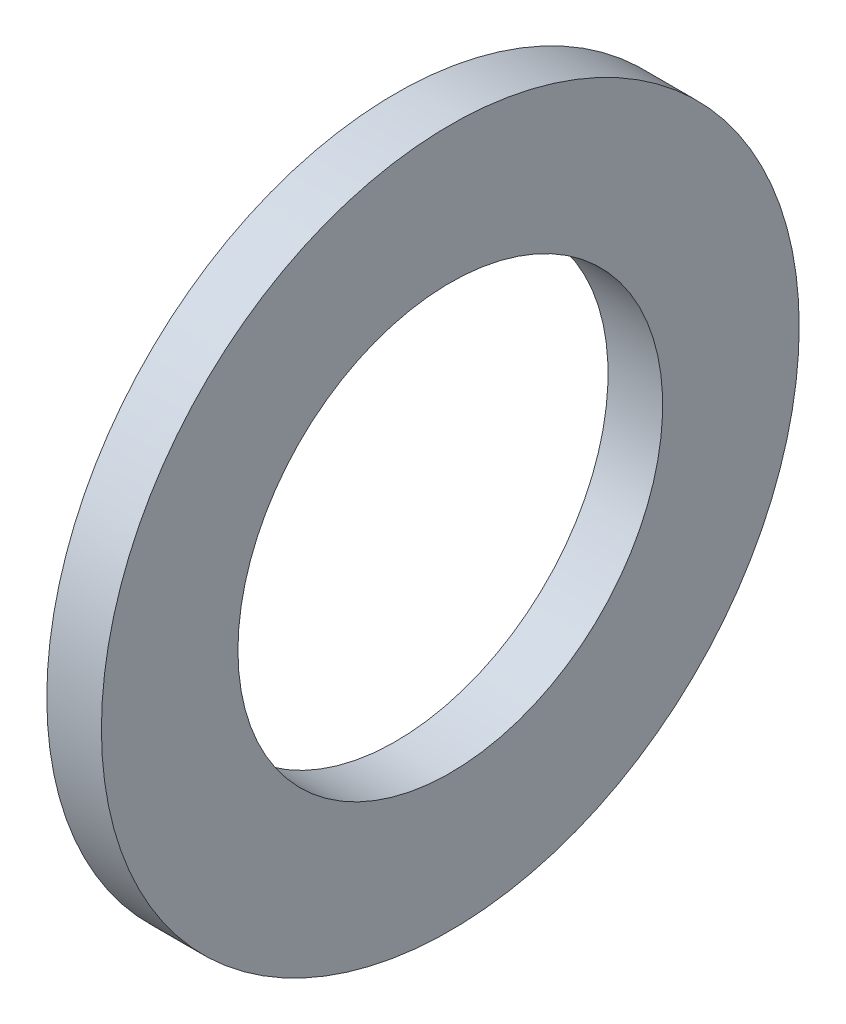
SolidWorks part; units mm, degrees
ref_plane "Plane1" through (0, 0, 0) normal (0, 0, 1) x (1, 0, 0)
ref_plane "Plane2" through (0, 0, 0) normal (0, 1, 0) x (1, 0, 0)
ref_plane "Plane3" through (0, 0, 0) normal (1, 0, 0) x (0, 0, -1)
other "Configuration Table"
sketch "Sketch1" plane through (0, 0, 0) normal (0, 0, 1) x (1, 0, 0)
  line L0 (-34.925, 0) -> (9.525, 0) construction
  line L1 (0, 35) -> (0, 57.5)
  line L2 (0, 57.5) -> (-9, 57.5)
  line L3 (-9, 57.5) -> (-9, 35)
  line L4 (-9, 35) -> (0, 35)
  dimension "Thickness" = 9
  dimension "Inside_dia" = 70
  dimension "Outside_dia" = 115
revolve "Base-Revolve" add sketch "Sketch1" angle 360 about L0
